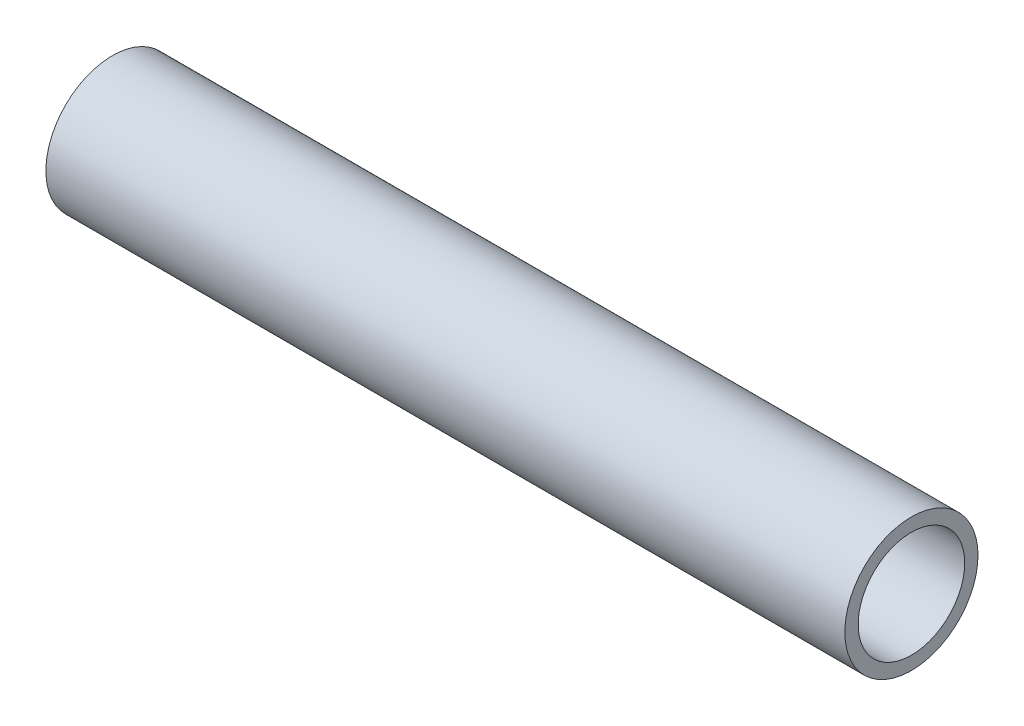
SolidWorks part; units mm, degrees
ref_plane "Plan de face" through (0, 0, 0) normal (0, 0, 1) x (1, 0, 0)
ref_plane "Plan de dessus" through (0, 0, 0) normal (0, 1, 0) x (1, 0, 0)
ref_plane "Plan de droite" through (0, 0, 0) normal (1, 0, 0) x (0, 0, -1)
sketch "Esquisse1" plane through (0, 0, 0) normal (1, 0, 0) x (0, 0, -1)
  circle A0 centre (0, 0) radius 5
  circle A1 centre (0, 0) radius 4
  dimension "D1" = 8
  dimension "D2" = 10
extrude "Boss.-Extru.1" add sketch "Esquisse1" along normal mid plane 60
